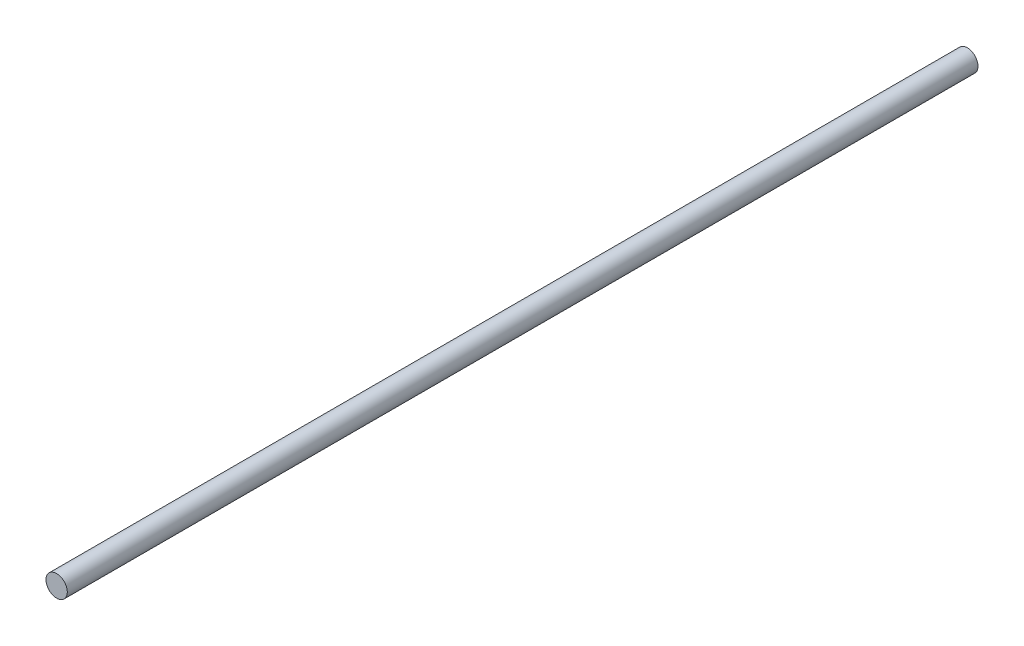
SolidWorks part; units mm, degrees
ref_plane "Front Plane" through (0, 0, 0) normal (0, 0, 1) x (1, 0, 0)
ref_plane "Top Plane" through (0, 0, 0) normal (0, 1, 0) x (1, 0, 0)
ref_plane "Right Plane" through (0, 0, 0) normal (1, 0, 0) x (0, 0, -1)
sketch "Sketch1" plane through (0, 0, 0) normal (0, 0, 1) x (1, 0, 0)
  circle A0 centre (0, 0) radius 2.0828
  dimension "D1" = 4.1656
extrude "Boss-Extrude1" add sketch "Sketch1" along normal mid plane 177.8
